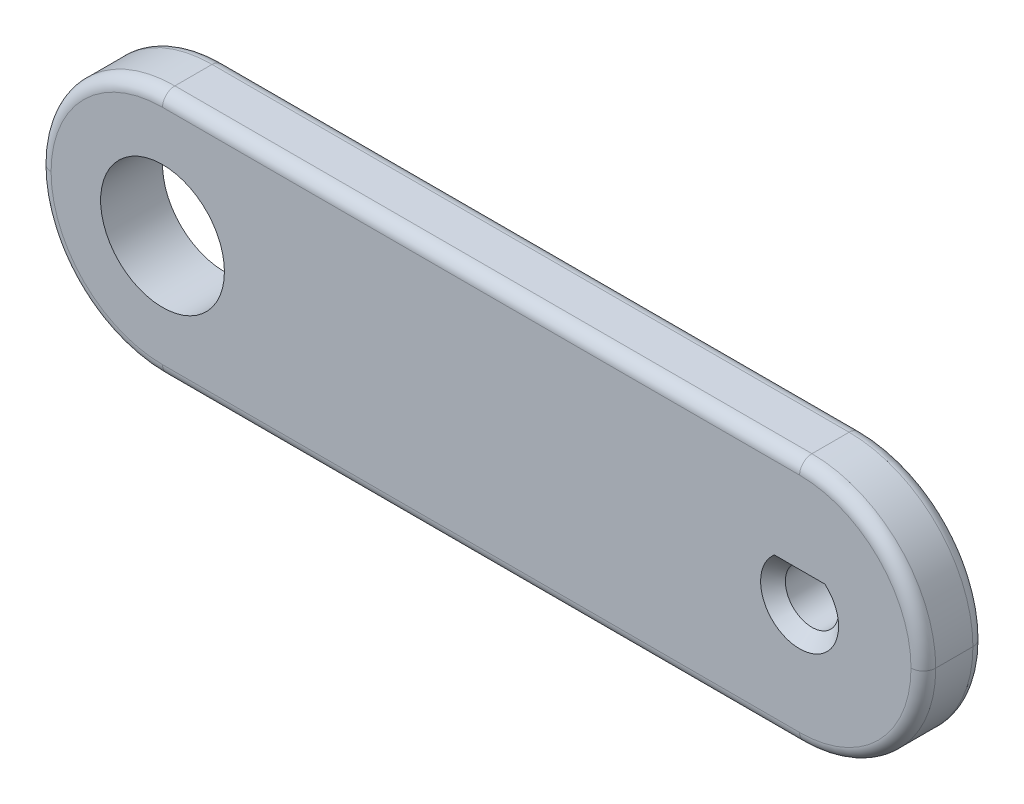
SolidWorks part; units mm, degrees
ref_plane "Alzado" through (0, 0, 0) normal (0, 0, 1) x (1, 0, 0)
ref_plane "Planta" through (0, 0, 0) normal (0, 1, 0) x (1, 0, 0)
ref_plane "Vista lateral" through (0, 0, 0) normal (1, 0, 0) x (0, 0, -1)
sketch "Croquis1" plane through (0, 0, 0) normal (0, 0, 1) x (1, 0, 0)
  line L1 (0, 0) -> (-71.46, 0)
  line L2 (0, 0) -> (0, 20)
  line L3 (0, 20) -> (-71.46, 20)
  line L4 (-71.46, 0) -> (-71.46, 20)
  circle A0 centre (-61.46, 10) radius 5
  circle A1 centre (-10, 10) radius 5
  point P10 (0, 10)
  dimension "D2" = 10
  dimension "D3" = 10
  dimension "D1" = 10
  dimension "D4" = 20
  dimension "D5" = 51.46
  dimension "D6" = 10
extrude "Saliente-Extruir1" add sketch "Croquis1" along normal blind 5
fillet "Redondeo2" radius 10 4 edges at (-71.46, 0, 2.5) (-71.46, 20, 2.5) (0, 0, 2.5) (0, 20, 2.5)
fillet "Redondeo3" radius 1 12 edges at (-2.9289, 17.0711, 0) (-2.9289, 2.9289, 0) (-35.73, 0, 0) (-68.5311, 2.9289, 0) (-68.5311, 17.0711, 0) (-2.9289, 17.0711, 5) (-2.9289, 2.9289, 5) (-35.73, 0, 5) (-68.5311, 2.9289, 5) (-68.5311, 17.0711, 5) (-35.73, 20, 0) (-35.73, 20, 5)
sketch "Croquis2" plane through (0, 0, 5) normal (0, 0, 1) x (1, 0, 0)
  line L0 (-11.6317, 11.4) -> (-8.3683, 11.4)
  circle A0 centre (-10, 10) radius 5
  arc A1 (-11.6317, 11.4) -> (-8.3683, 11.4) centre (-10, 10) ccw
  dimension "D1" = 4.3
  dimension "D2" = 1.4
extrude "Saliente-Extruir2" add sketch "Croquis2" against normal up to surface (5 mm away)
chamfer "Chaflán1" distance 1 angle 45 2 edges at (-10, 7.85, 5) (-10, 11.4, 5)
